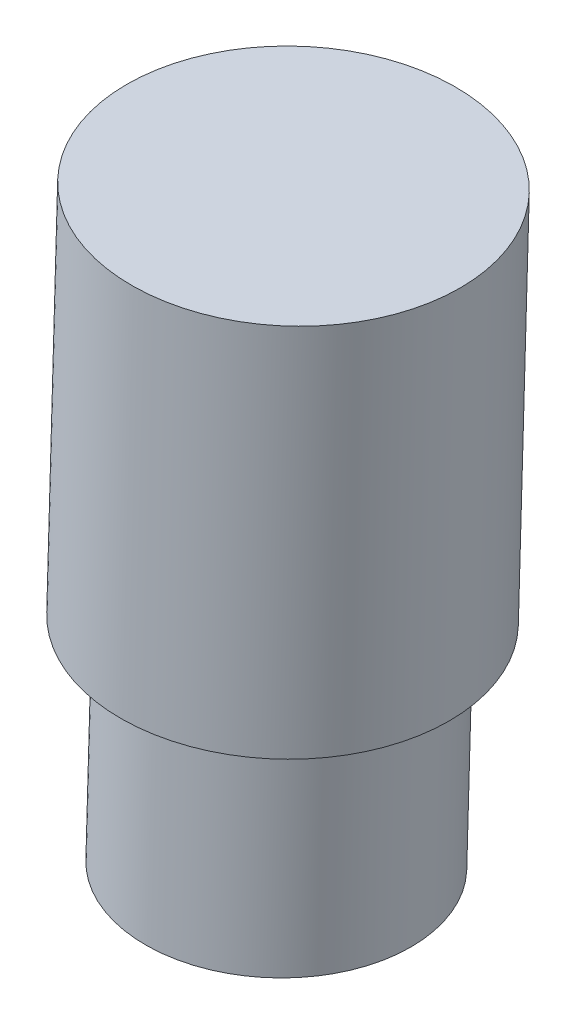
SolidWorks part; units mm, degrees
ref_plane "Plan de face" through (0, 0, 0) normal (0, 0, 1) x (1, 0, 0)
ref_plane "Plan de dessus" through (0, 0, 0) normal (0, 1, 0) x (1, 0, 0)
ref_plane "Plan de droite" through (0, 0, 0) normal (1, 0, 0) x (0, 0, -1)
ref_plane "Plan4" through (0, 0, -182.3501) normal (0, 0, -1) x (-1, 0, 0)
sketch "Esquisse1" plane through (0, 0, -182.3501) normal (0, 0, -1) x (-1, 0, 0)
  line L0 (226.8177, 3.59) -> (234.5617, 3.8129)
  line L1 (234.5617, 3.8129) -> (233.5745, 38.1088)
  line L2 (233.5745, 38.1088) -> (223.9858, 37.8328)
  line L3 (223.9858, 37.8328) -> (224.6157, 15.9521)
  line L4 (224.6157, 15.9521) -> (226.4603, 16.0052)
  line L5 (226.4603, 16.0052) -> (226.8177, 3.59)
  line L6 (234.5682, 3.5902) -> (233.5666, 38.3846) construction
revolve "Révolution1" add sketch "Esquisse1" angle 360 about L6
